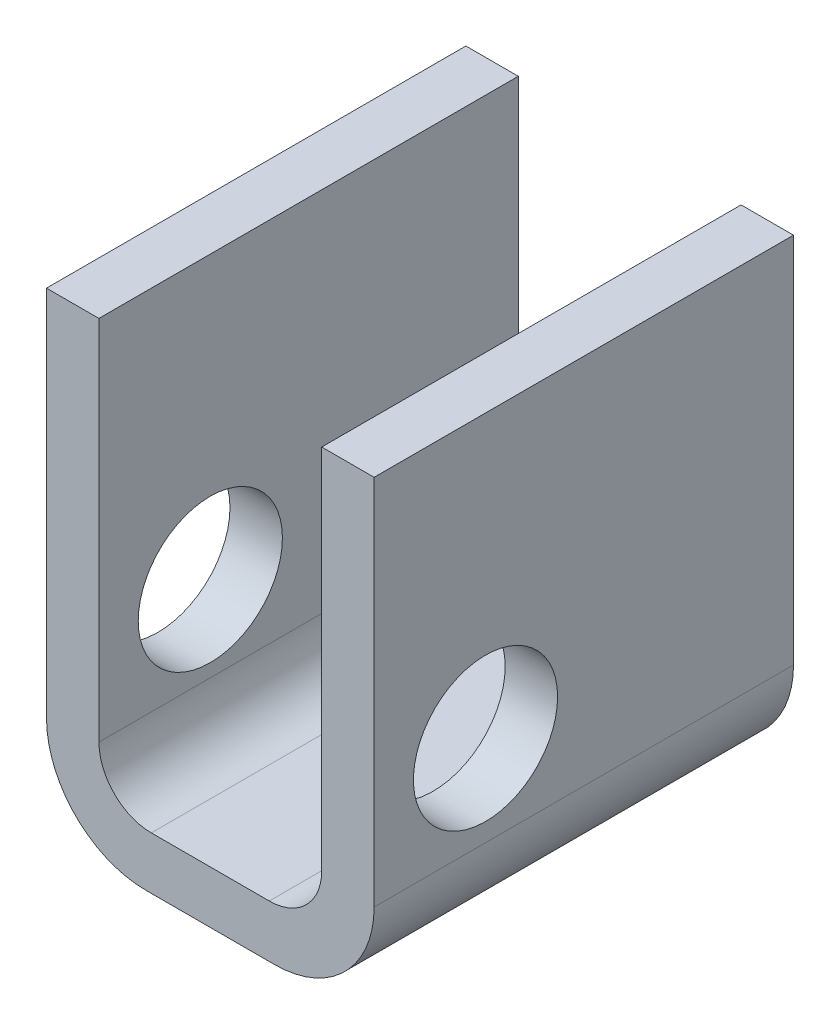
SolidWorks part; units mm, degrees
ref_plane "Front Plane" through (0, 0, 0) normal (0, 0, 1) x (1, 0, 0)
ref_plane "Top Plane" through (0, 0, 0) normal (0, 1, 0) x (1, 0, 0)
ref_plane "Right Plane" through (0, 0, 0) normal (1, 0, 0) x (0, 0, -1)
sketch "Sketch1" plane through (0, 0, 0) normal (0, 0, 1) x (1, 0, 0)
  line L0 (238.5147, 109.5206) -> (238.5147, 153.9706)
  line L1 (244.8647, 108.8882) -> (244.8647, 153.9706)
  line L2 (211.5272, 153.9706) -> (211.5272, 109.5206)
  line L3 (205.1772, 108.8882) -> (205.1772, 153.9706)
  line L4 (217.8772, 103.1706) -> (232.1647, 103.1706)
  line L5 (217.2448, 96.8206) -> (232.7972, 96.8206)
  line L6 (238.5147, 153.9706) -> (244.8647, 153.9706)
  line L8 (205.1772, 153.9706) -> (211.5272, 153.9706)
  arc A0 (217.8772, 103.1706) -> (211.5272, 109.5206) centre (217.8772, 109.5206) cw
  arc A1 (232.1647, 103.1706) -> (238.5147, 109.5206) centre (232.1647, 109.5206) ccw
  arc A2 (217.2448, 96.8206) -> (205.1772, 108.8882) centre (217.2448, 108.8882) cw
  arc A3 (232.7972, 96.8206) -> (244.8647, 108.8882) centre (232.7972, 108.8882) ccw
  dimension "D1" = 6.35
  dimension "D2" = 12.0675
extrude "Extrude1" add sketch "Sketch1" along normal blind 50.8
ref_plane "Plane2" through (225.021, 0, 0) normal (1, 0, 0) x (0, 0, -1)
sketch "Sketch2" plane through (244.8647, 0, 0) normal (1, 0, 0) x (0, 0, -1)
  line L0 (-50.8, 153.9706) -> (0, 153.9706) construction
  line L6 (-50.8, 108.8882) -> (-50.8, 153.9706) construction
  circle A0 centre (-37.3062, 119.8394) radius 8.7313
  dimension "D2" = 17.4625
  dimension "D3" = 4.7625
  dimension "D1" = 25.4
extrude "Extrude2" cut sketch "Sketch2" against normal through all
